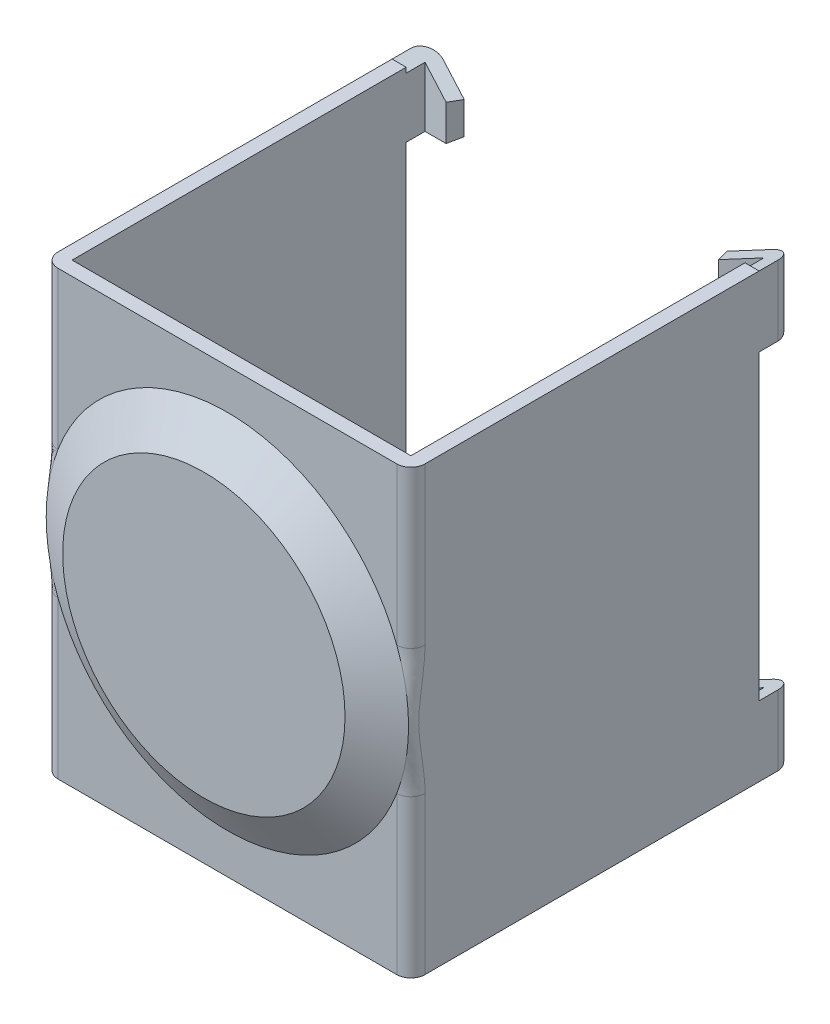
SolidWorks part; units mm, degrees
ref_plane "Front Plane" through (0, 0, 0) normal (0, 0, 1) x (1, 0, 0)
ref_plane "Top Plane" through (0, 0, 0) normal (0, 1, 0) x (1, 0, 0)
ref_plane "Right Plane" through (0, 0, 0) normal (1, 0, 0) x (0, 0, -1)
imported_body "Imported3"
sketch "Sketch1" plane through (0, 0, 5.7) normal (0, 0, 1) x (1, 0, 0)
  circle A0 centre (60, 295) radius 7.7
extrude "Extrude1" add sketch "Sketch1" along normal blind 1 draft 59.534
fillet "Fillet1" radius 0.6 1 edges at (52.2, 295, 5.7)
fillet "Fillet2" radius 0.6 1 edges at (67.8, 295, 5.7)
